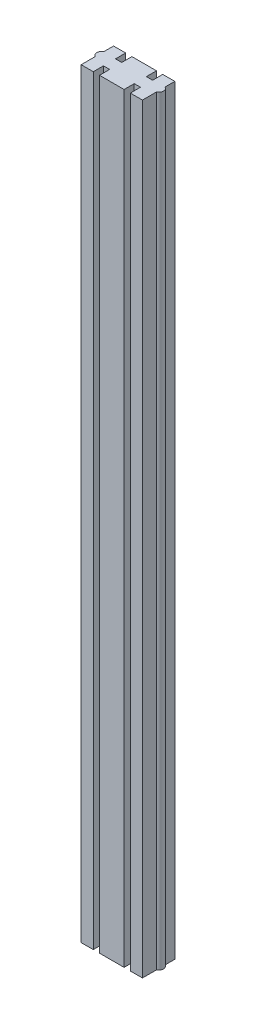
SolidWorks part; units mm, degrees
ref_plane "Front Plane" through (0, 0, 0) normal (0, 0, 1) x (1, 0, 0)
ref_plane "Top Plane" through (0, 0, 0) normal (0, 1, 0) x (1, 0, 0)
ref_plane "Right Plane" through (0, 0, 0) normal (1, 0, 0) x (0, 0, -1)
sketch "Sketch1" plane through (0, 0, 0) normal (0, 1, 0) x (1, 0, 0)
  line L0 (0, 21.082) -> (7.874, 21.082) construction
  line L1 (0, 0) -> (7.874, 0)
  line L2 (0, 0) -> (0, 9.1672)
  line L3 (0, 21.082) -> (7.874, 21.082)
  line L4 (39.878, 0) -> (39.878, 9.1672)
  line L5 (7.874, 21.082) -> (7.874, 14.478) construction
  line L6 (7.874, 14.478) -> (11.938, 14.478) construction
  line L7 (11.938, 14.478) -> (11.938, 21.082) construction
  line L8 (19.939, 21.082) -> (19.939, 0) construction
  line L9 (3.979, 10.541) -> (39.878, 10.541) construction
  line L11 (7.874, 21.082) -> (7.874, 14.478)
  line L12 (7.874, 14.478) -> (11.938, 14.478)
  line L13 (11.938, 21.082) -> (11.938, 14.478)
  line L14 (32.004, 14.478) -> (27.94, 14.478)
  line L15 (27.94, 21.082) -> (27.94, 14.478)
  line L17 (32.004, 21.082) -> (32.004, 14.478)
  line L18 (7.874, 6.604) -> (11.938, 6.604)
  line L19 (11.938, 0) -> (11.938, 6.604)
  line L21 (7.874, 0) -> (7.874, 6.604)
  line L22 (32.004, 0) -> (32.004, 6.604)
  line L24 (27.94, 0) -> (27.94, 6.604)
  line L25 (32.004, 6.604) -> (27.94, 6.604)
  line L26 (39.878, 21.082) -> (39.878, 14.986) construction
  line L27 (32.004, 21.082) -> (39.878, 21.082)
  line L28 (38.608, 14.986) -> (38.608, 11.938) construction
  line L29 (32.004, 0) -> (39.878, 0)
  line L30 (39.878, 14.7088) -> (39.878, 21.082)
  line L31 (11.938, 21.082) -> (27.94, 21.082)
  line L32 (11.938, 0) -> (27.94, 0)
  line L33 (0, 14.7088) -> (0, 21.082)
  arc A0 (39.878, 9.1672) -> (39.878, 14.7088) centre (38.608, 11.938) ccw
  arc A1 (0, 9.1672) -> (0, 14.7088) centre (1.27, 11.938) cw
  dimension "D1" = 21.082
  dimension "D2" = 39.878
  dimension "D3" = 7.874
  dimension "D4" = 4.064
  dimension "D5" = 6.604
  dimension "D7" = 1.27
  dimension "D8" = 3.048
extrude "Boss-Extrude1" add sketch "Sketch1" along normal blind 495.0079
